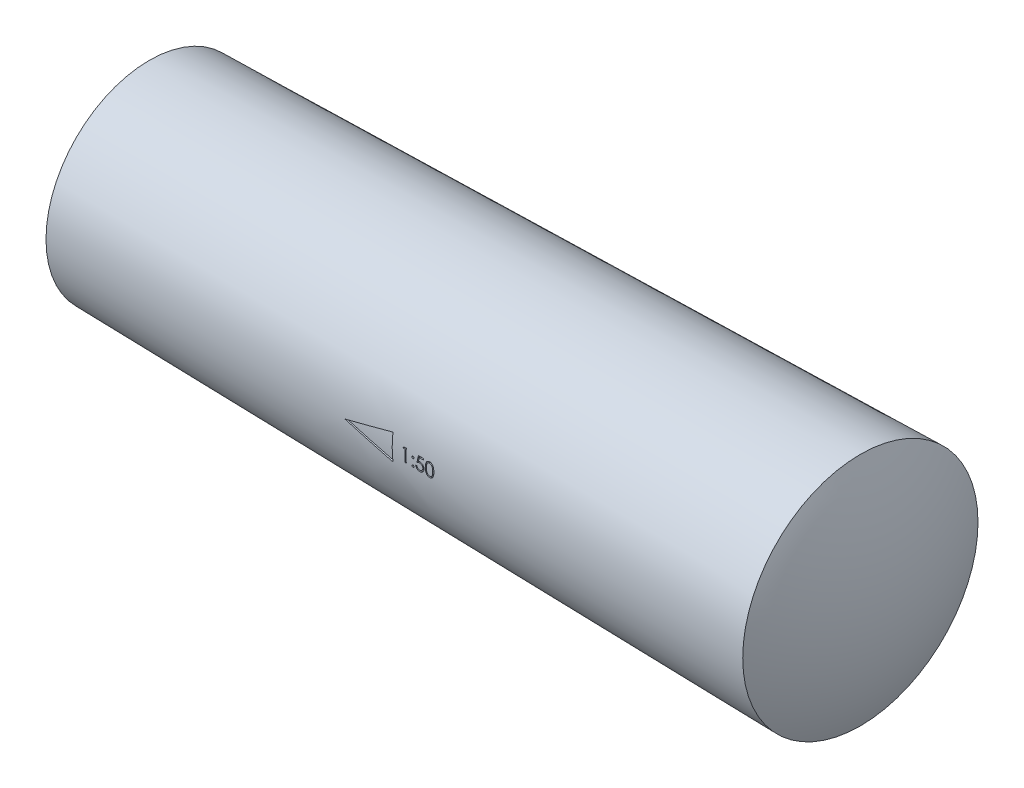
SolidWorks part; units mm, degrees
ref_plane "Front Plane" through (0, 0, 0) normal (0, 0, 1) x (1, 0, 0)
ref_plane "Top Plane" through (0, 0, 0) normal (0, 1, 0) x (1, 0, 0)
ref_plane "Right Plane" through (0, 0, 0) normal (1, 0, 0) x (0, 0, -1)
sketch "Sketch1" plane through (0, 0, 0) normal (1, 0, 0) x (0, 0, -1)
  circle A0 centre (0, 0) radius 8
  dimension "D1" = 16
extrude "Extrude1" add sketch "Sketch1" along normal mid plane 55
draft "Draft1" type of draft neutral plane draft angle 1.146 faces to draft 1 parameters "D1"=1.146
sketch "Sketch2" plane through (0, 0, 0) normal (0, 0, 1) x (1, 0, 0)
  line L0 (-27.5, 0) -> (-27.5, 8)
  line L1 (-27.5, 8) -> (-27.5, -8) construction
  line L2 (-27.5, 0) -> (-29.5, 0)
  line L3 (-29.5, 0) -> (-29.5, -8.55) construction
  line L4 (27.5, 0) -> (27.5, 9.1)
  line L5 (27.5, -9.1) -> (27.5, 9.1) construction
  line L6 (27.5, 0) -> (29.5, 0)
  line L7 (29.5, 0) -> (29.5, -8.55) construction
  line L8 (-27.5, -8) -> (27.5, -9.1) construction
  arc A0 (-29.5, 0) -> (-27.5, 8) centre (-12.5, 0) cw
  arc A1 (29.5, 0) -> (27.5, 9.1) centre (7.7973, 0) ccw
  point P14 (0, -8.55)
revolve "Revolve1" add sketch "Sketch2" angle 360 about L2
sketch "Sketch5" plane through (0, 0, 0) normal (0, 0, 1) x (1, 0, 0)
  line L0 (0, 8.55) -> (0, -8.55) construction
  line L1 (27.5, 9.1) -> (-27.5, 8) construction
  line L2 (-27.5, -8) -> (27.5, -9.1) construction
ref_plane "Plane2" through (0, 0, 0) normal (-0.02, 0, 0.9998) x (0.9998, 0, 0.02)
sketch "Sketch6" plane through (0, 0, 0) normal (-0.02, 0, 0.9998) x (0.9998, 0, 0.02)
  line L0 (0, 0) -> (0, 1)
  line L1 (0, 8.55) -> (0, -8.55) construction
  line L2 (0, 1) -> (-3.7321, 0)
  line L3 (-3.7321, 0) -> (0, -1)
  line L4 (0, -1) -> (0, 0)
  line L5 (0, -0.5) -> (4, -0.5) construction
  text T0 "1:50" font "Century Gothic" height 1
  dimension "D1" = 2
  dimension "D2" = 30
  dimension "D3" = 4
wrap "Wrap2" sketch "Sketch6" wrap type deboss source sketch "Sketch6" thickness 0.1 parameters "D1"=0.1
equation "\"D2@Sketch2\" = \"D1@Sketch2\""
